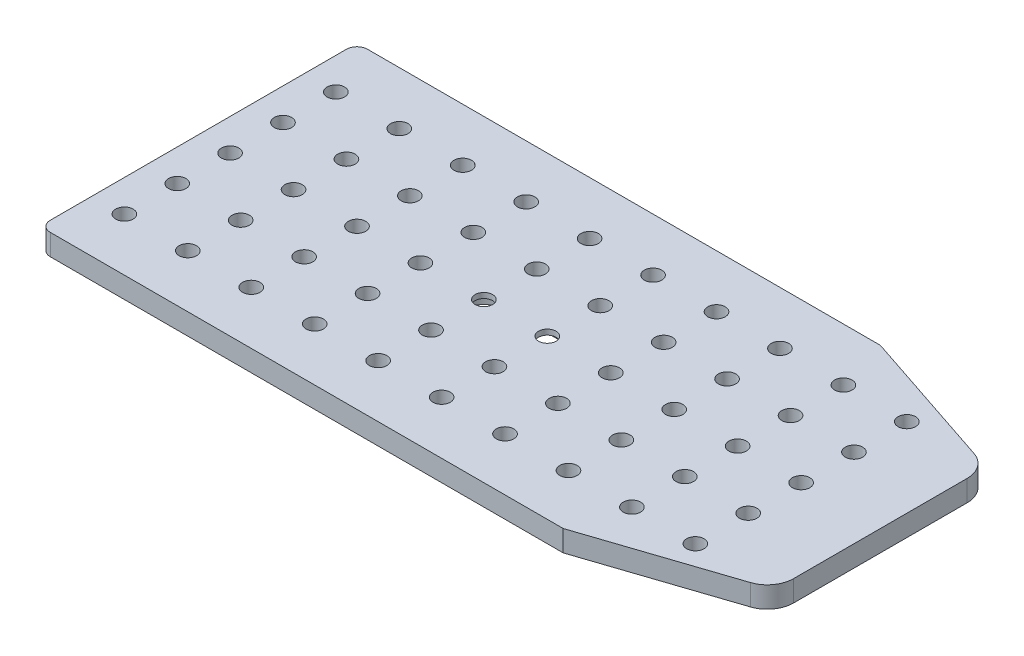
SolidWorks part; units mm, degrees
ref_plane "Front Plane" through (0, 0, 0) normal (0, 0, 1) x (1, 0, 0)
ref_plane "Top Plane" through (0, 0, 0) normal (0, 1, 0) x (1, 0, 0)
ref_plane "Right Plane" through (0, 0, 0) normal (1, 0, 0) x (0, 0, -1)
sketch "Sketch1" plane through (0, 0, 0) normal (0, 1, 0) x (1, 0, 0)
  line L0 (-75, 25) -> (-22.5, 25)
  line L1 (-75, 25) -> (75, 25)
  line L2 (-75, 25) -> (-75, -25)
  line L3 (-75, -25) -> (75, -25)
  line L4 (75, 25) -> (75, -25)
  line L5 (-75, 25) -> (75, -25) construction
  line L6 (-75, -25) -> (75, 25) construction
  line L7 (-75, 0) -> (-51.8537, 0) construction
  line L8 (-75, 25) -> (75, 25)
  line L9 (-75, 25) -> (-75, 45)
  line L10 (-75, 45) -> (75, 45)
  line L11 (75, 25) -> (75, 45)
  line L12 (-75, -45) -> (75, -45)
  line L13 (75, -25) -> (75, -45)
  line L14 (-75, -25) -> (75, -25)
  line L15 (-75, -25) -> (-75, -45)
  line L17 (-75, -25) -> (75, -25)
  line L18 (-75, -25) -> (-75, -45)
  line L19 (-75, -45) -> (75, -45)
  line L20 (75, -25) -> (75, -45)
  point P0 (0, 0)
  dimension "D1" = 50
  dimension "D2" = 150
  dimension "D3" = 20
extrude "Boss-Extrude1" add sketch "Sketch1" along normal blind 4 contours L1 L11 L10 L9 L0 | L4 L1 L0 L2 L3 | L3 L15 L12 L13
fillet "Fillet1" radius 5 4 edges at (-75, 2, -45) (75, 2, -45) (75, 2, 45) (-75, 2, 45)
sketch "Sketch2" plane through (0, 4, 0) normal (0, 1, 0) x (1, 0, 0)
  line L0 (-75, 0) -> (-25, 0) construction
  line L1 (-75, -40) -> (-75, 40) construction
  line L3 (-70, 20) -> (-30, 20)
  line L4 (-70, 20) -> (-70, -20)
  line L5 (-70, -20) -> (-30, -20)
  line L6 (-30, 20) -> (-30, -20)
  line L7 (-70, 20) -> (-30, -20) construction
  line L8 (-70, -20) -> (-30, 20) construction
  circle A0 centre (-70, 20) radius 1.65
  circle A1 centre (-60, 20) radius 1.65
  circle A2 centre (-50, 20) radius 1.65
  circle A3 centre (-40, 20) radius 1.65
  circle A4 centre (-30, 20) radius 1.65
  circle A5 centre (-60, 10) radius 1.65
  circle A6 centre (-50, 10) radius 1.65
  circle A7 centre (-40, 10) radius 1.65
  circle A8 centre (-30, 10) radius 1.65
  circle A9 centre (-60, 0) radius 1.65
  circle A10 centre (-50, 0) radius 1.65
  circle A11 centre (-40, 0) radius 1.65
  circle A12 centre (-30, 0) radius 1.65
  circle A13 centre (-60, -10) radius 1.65
  circle A14 centre (-50, -10) radius 1.65
  circle A15 centre (-40, -10) radius 1.65
  circle A16 centre (-30, -10) radius 1.65
  circle A17 centre (-60, -20) radius 1.65
  circle A18 centre (-50, -20) radius 1.65
  circle A19 centre (-40, -20) radius 1.65
  circle A20 centre (-30, -20) radius 1.65
  circle A21 centre (-70, 10) radius 1.65
  circle A22 centre (-70, 0) radius 1.65
  circle A23 centre (-70, -10) radius 1.65
  circle A24 centre (-70, -20) radius 1.65
  circle A25 centre (-18, 20) radius 1.65
  circle A26 centre (-18, 10) radius 1.65
  circle A27 centre (-18, 0) radius 1.65
  circle A28 centre (-18, -10) radius 1.65
  circle A29 centre (-18, -20) radius 1.65
  circle A30 centre (-6, 20) radius 1.65
  circle A31 centre (-6, 10) radius 1.65
  circle A32 centre (-6, 0) radius 1.65
  circle A33 centre (-6, -10) radius 1.65
  circle A34 centre (-6, -20) radius 1.65
  circle A35 centre (6, 20) radius 1.65
  circle A36 centre (6, 10) radius 1.65
  circle A37 centre (6, 0) radius 1.65
  circle A38 centre (6, -10) radius 1.65
  circle A39 centre (6, -20) radius 1.65
  circle A40 centre (18, 20) radius 1.65
  circle A41 centre (18, 10) radius 1.65
  circle A42 centre (18, 0) radius 1.65
  circle A43 centre (18, -10) radius 1.65
  circle A44 centre (18, -20) radius 1.65
  circle A45 centre (30, 20) radius 1.65
  circle A46 centre (30, 10) radius 1.65
  circle A47 centre (30, 0) radius 1.65
  circle A48 centre (30, -10) radius 1.65
  circle A49 centre (30, -20) radius 1.65
  circle A50 centre (42, 20) radius 1.65
  circle A51 centre (42, 10) radius 1.65
  circle A52 centre (42, 0) radius 1.65
  circle A53 centre (42, -10) radius 1.65
  circle A54 centre (42, -20) radius 1.65
  circle A55 centre (54, 20) radius 1.65
  circle A56 centre (54, 10) radius 1.65
  circle A57 centre (54, 0) radius 1.65
  circle A58 centre (54, -10) radius 1.65
  circle A59 centre (54, -20) radius 1.65
  point P5 (-50, 0)
  dimension "D4" = 5
  dimension "D1" = 40
  dimension "D2" = 40
  dimension "D3" = 50
  dimension "D5" = 5
  dimension "D6" = 8
extrude "Cut-Extrude1" cut sketch "Sketch2" against normal mid plane 8 contours A6 | A5 | L4 A21 | L4 A21 | L6 A12 | L6 A12 | A11 | A10 | A9 | L4 A22 | L4 A22 | L4 A23 | L4 A23 | A13 | A14 | A15 | L6 A16 | L6 A16 | L5 A20 L6 | L6 A20 L5 | L5 A19 | L5 A19 | L5 A18 | L5 A18 | L5 A17 | L5 A17 | A29 | A28 | A27 | A26 | A25 | A30 | A35 | A40 | A31 | A36 | A41 | A46 | A51 | A56 | A57 | A58 | A59 | A54 | A52 | A48 | A47 | A49 | A44 | A34 | A33 | A32 | A37 | A38 | A39 | A43 | A42 | A45 | A50 | A55 | A1 | A2 | A3 | A4 | A8 | A7 | A24 | A53 | A0
sketch "Sketch3" plane through (0, 4, 0) normal (0, 1, 0) x (1, 0, 0)
  circle A0 centre (-70, 20) radius 2
extrude "Cut-Extrude2" cut sketch "Sketch3" along normal mid plane 8
sketch "Sketch4" plane through (0, 4, 0) normal (0, 1, 0) x (1, 0, 0)
  line L0 (-75, -30) -> (-25, -30)
  line L9 (-75, 30) -> (-25, -30) construction
  line L10 (-75, -30) -> (-25, 30) construction
  line L11 (-25, -45) -> (-25, -30)
  line L12 (-70, -45) -> (70, -45) construction
  line L13 (-75, 0) -> (-54.7832, 0) construction
  line L14 (-25, -30) -> (-87.892, -30)
  line L15 (-25, -30) -> (-25, -45)
  line L16 (-25, -45) -> (-87.892, -45)
  line L17 (-87.892, -30) -> (-87.892, -45)
  line L18 (-25, 45) -> (-87.892, 45)
  line L19 (-87.892, 30) -> (-87.892, 45)
  line L20 (-25, 30) -> (-87.892, 30)
  line L21 (-25, 30) -> (-25, 45)
  line L22 (-75, 0) -> (-23.7735, 0)
  point P6 (-50, 0)
  dimension "D1" = 50
  dimension "D2" = 30
  dimension "D3" = 30
extrude "Cut-Extrude3" cut sketch "Sketch4" against normal blind 33
fillet "Fillet2" radius 5 2 edges at (-25, 2, 45) (-25, 2, -45)
sketch "Sketch14" plane through (0, 4, 0) normal (0, 1, 0) x (1, 0, 0)
  line L0 (75, 0) -> (59.2452, 0)
  line L2 (75, -40) -> (75, 40) construction
  line L3 (25, 33) -> (25, 45)
  line L4 (65, 39) -> (35, 39) construction
  line L5 (-20, 45) -> (70, 45) construction
  line L6 (65, 42) -> (35, 42)
  line L7 (25, 39) -> (-25, 39)
  line L8 (-25, 30) -> (-25, 40) construction
  line L11 (-15, 39) -> (15, 39) construction
  line L14 (-15, 42) -> (15, 42)
  line L17 (-15, 36) -> (15, 36)
  line L20 (-25, -30) -> (75, -30)
  line L21 (65, 36) -> (35, 36)
  line L30 (65, -39) -> (35, -39) construction
  line L33 (65, -42) -> (35, -42)
  line L34 (65, -36) -> (35, -36)
  line L35 (-15, -39) -> (15, -39) construction
  line L36 (-15, -42) -> (15, -42)
  line L37 (-15, -36) -> (15, -36)
  line L38 (-25, 30) -> (75, 30)
  arc A16 (-15, 42) -> (-15, 36) centre (-15, 39) ccw
  arc A17 (15, 36) -> (15, 42) centre (15, 39) ccw
  arc A20 (65, -42) -> (65, -36) centre (65, -39) ccw
  arc A21 (35, -36) -> (35, -42) centre (35, -39) ccw
  arc A22 (-15, -42) -> (-15, -36) centre (-15, -39) cw
  arc A23 (15, -36) -> (15, -42) centre (15, -39) cw
  arc A24 (65, 42) -> (65, 36) centre (65, 39) cw
  arc A25 (35, 36) -> (35, 42) centre (35, 39) cw
  point P17 (0, 39)
  point P24 (50, 39)
  point P31 (50, -39)
  point P38 (0, -39)
  dimension "D2" = 30
  dimension "D1" = 6
  dimension "D3" = 3
  dimension "D4" = 50
  dimension "D5" = 12
  dimension "D6" = 30
extrude "Cut-Extrude4" cut sketch "Sketch14" against normal blind 3 contours L17 A17 L7 A16 | L7 A17 L14 A16 | A25 L21 A24 L6 | A23 L37 A22 L36 | L34 A21 L33 A20
sketch "Sketch15" plane through (0, 4, 0) normal (0, 1, 0) x (1, 0, 0)
  line L0 (-25, 30) -> (75, 30)
  line L1 (75, -40) -> (75, 40) construction
  line L2 (-25, -30) -> (75, -30)
  line L3 (75, 0) -> (105, 0) construction
  line L4 (105, 20) -> (105, -20)
  line L5 (75, 30) -> (105, 20)
  line L6 (105, -20) -> (75, -30)
  line L7 (75, 30) -> (75, -30)
  point P14 (105, 0)
  dimension "D1" = 30
  dimension "D2" = 40
extrude "Boss-Extrude2" add sketch "Sketch15" against normal blind 4 contours L3 L7 L6 L4 | L7 L3 L4 L5
fillet "Fillet3" radius 5 2 edges at (105, 2, -20) (105, 2, 20)
sketch "Sketch16" plane through (0, 4, 0) normal (0, 1, 0) x (1, 0, 0)
  line L0 (54, 0) -> (105, 0)
  line L1 (105, 16.3962) -> (105, -16.3962) construction
  line L2 (54, 0) -> (66, 0)
  circle A0 centre (66, 0) radius 1.65
  circle A1 centre (78, 0) radius 1.65
  circle A2 centre (90, 0) radius 1.65
  circle A3 centre (78, 10) radius 1.65
  circle A4 centre (90, 10) radius 1.65
  circle A5 centre (78, 20) radius 1.65
  circle A6 centre (90, 20) radius 1.65
  circle A7 centre (66, 10) radius 1.65
  circle A8 centre (66, 20) radius 1.65
  circle A9 centre (66, -10) radius 1.65
  circle A10 centre (78, -10) radius 1.65
  circle A11 centre (90, -10) radius 1.65
  circle A12 centre (66, -20) radius 1.65
  circle A13 centre (78, -20) radius 1.65
  circle A14 centre (90, -20) radius 1.65
  dimension "D2" = 3
  dimension "D1" = 12
  dimension "D3" = 3
  dimension "D4" = 3
extrude "Cut-Extrude5" cut sketch "Sketch16" against normal blind 3 contours A5 | A6 | A7 | A3 | A4 | A11 | A14 | A8 | A2 | A1 | A0 | A9 | A12 | A13 | A10
sketch "Sketch18" plane through (0, 0, 0) normal (0, -1, 0) x (-1, 0, 0)
  line L0 (-30, 0) -> (-42, 0) construction
  line L1 (-30, -4.5) -> (-42, -4.5)
  line L2 (-30, 4.5) -> (-42, 4.5)
  arc A0 (-30, -4.5) -> (-30, 4.5) centre (-30, 0) ccw
  arc A1 (-42, 4.5) -> (-42, -4.5) centre (-42, 0) ccw
  point P4 (-36, 0)
  dimension "D1" = 9
extrude "Cut-Extrude6" cut sketch "Sketch18" against normal blind 3
fillet "Fillet4" radius 5 2 edges at (-75, 2, 30) (-75, 2, -30)
sketch "Sketch19" plane through (0, 4, 0) normal (0, 1, 0) x (1, 0, 0)
  line L1 (-25, 30) -> (84.5217, 30)
  line L2 (-25, 30) -> (-25, 54.4245)
  line L3 (-25, 54.4245) -> (84.5217, 54.4245)
  line L4 (84.5217, 30) -> (84.5217, 54.4245)
  line L5 (-25, -30) -> (79.1165, -30)
  line L6 (-25, -30) -> (-25, -60.5752)
  line L7 (-25, -60.5752) -> (79.1165, -60.5752)
  line L8 (79.1165, -30) -> (79.1165, -60.5752)
extrude "Cut-Extrude7" cut sketch "Sketch19" against normal blind 20
sketch "Sketch20" plane through (0, 4, 0) normal (0, 1, 0) x (1, 0, 0)
  line L0 (-30, 0) -> (-18, 0)
  line L6 (-87.5589, -42.8626) -> (-24, -42.8626)
  line L7 (-87.5589, -42.8626) -> (-87.5589, 38.2889)
  line L8 (-87.5589, 38.2889) -> (-24, 38.2889)
  line L9 (-24, -42.8626) -> (-24, 38.2889)
extrude "Cut-Extrude8" cut sketch "Sketch20" against normal blind 10
fillet "Fillet5" radius 2 2 edges at (-24, 2, -30) (-24, 2, 30)
